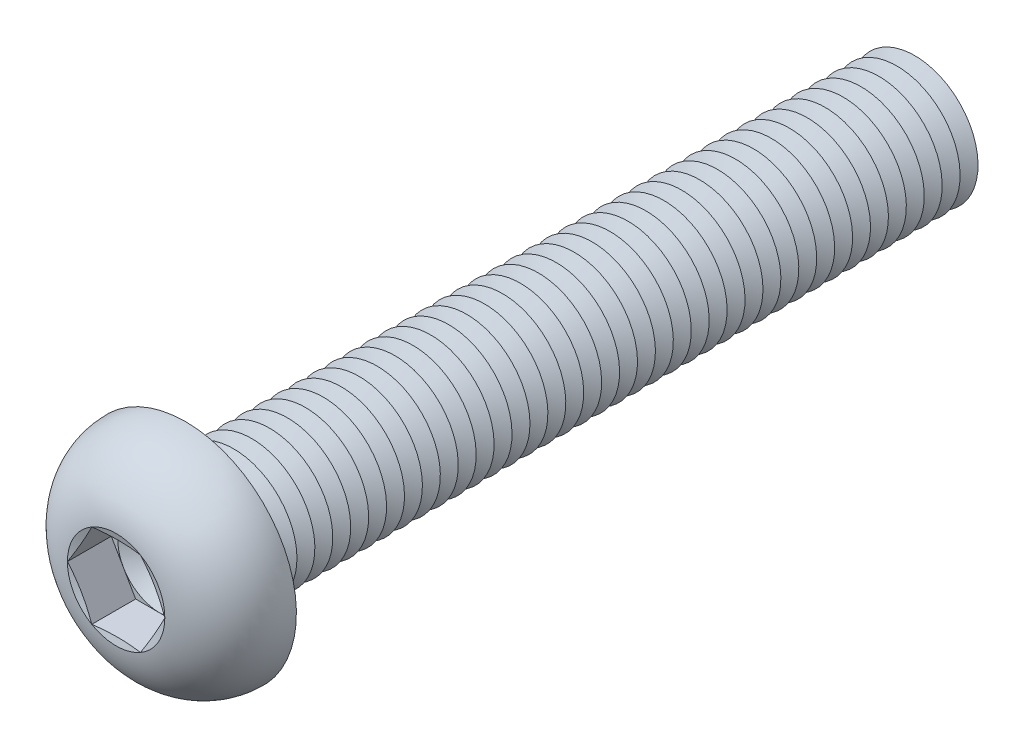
SolidWorks part; units mm, degrees
ref_plane "Front Plane" through (0, 0, 0) normal (0, 0, 1) x (1, 0, 0)
ref_plane "Top Plane" through (0, 0, 0) normal (0, 1, 0) x (1, 0, 0)
ref_plane "Right Plane" through (0, 0, 0) normal (1, 0, 0) x (0, 0, -1)
sketch "Sketch1" plane through (0, 0, 0) normal (1, 0, 0) x (0, 0, -1)
  line L0 (0, 6) -> (0, 10.5)
  line L3 (0, 6) -> (70, 6)
  line L4 (70, 6) -> (70, 0)
  line L5 (70, 0) -> (-6.6, 0) construction
  line L6 (-6.6, 0) -> (70, 0)
  line L7 (-6.6, 4.6188) -> (-6.6, 2.3094) construction
  line L8 (-6.6, 2.3094) -> (-6.6, 0)
  line L9 (-6.6, 4.6188) -> (-5.9812, 2.3094)
  line L10 (-5.9812, 2.3094) -> (-6.6, 2.3094)
  line L11 (70, 0) -> (22.7481, 0) construction
  line L12 (0, 10.5) -> (-6.6, 10.5) construction
  arc A1 (0, 10.5) -> (-6.6, 4.6188) centre (0, 3.8561) ccw
  point P8 (70, 3)
  dimension "D1" = 21
  dimension "D2" = 12
  dimension "D3" = 6.6
  dimension "D4" = 9.2376
  dimension "D5" = 70
  dimension "D6" = 15
revolve "Revolve1" add sketch "Sketch1" angle 360 about L5
fillet "Fillet1" radius 0.85 1 edges at (0, 6, 0)
sketch "Sketch2" plane through (0, 0, 0) normal (1, 0, 0) x (0, 0, -1)
  line L0 (69.15, 6) -> (70.85, 6)
  line L1 (70, 6) -> (0.85, 6) construction
  line L2 (70.85, 6) -> (70, 4.5278)
  line L3 (70, -6) -> (70, 6) construction
  line L4 (70, 4.5278) -> (69.15, 6)
  dimension "D1" = 1.7
revolve "Cut-Revolve1" cut sketch "Sketch2" angle 360 about axis through (0, 0, -70) along (0, 0, -1)
pattern_linear "LPattern1" count 41 spacing 1.7 along (0, 0, 1) of "Cut-Revolve1"
sketch "Sketch3" plane through (0, 0, 6.6) normal (0, 0, 1) x (1, 0, 0)
  line L7 (2.3094, 4) -> (-2.3094, 4)
  line L8 (-2.3094, 4) -> (-4.6188, 0)
  line L9 (-4.6188, 0) -> (-2.3094, -4)
  line L10 (-2.3094, -4) -> (2.3094, -4)
  line L11 (2.3094, -4) -> (4.6188, 0)
  line L12 (4.6188, 0) -> (2.3094, 4)
  circle A0 centre (0, 0) radius 4 construction
  circle A3 centre (0, 0) radius 4.6188 construction
extrude "Cut-Extrude1" cut sketch "Sketch3" against normal blind 4.16
sketch "Sketch4" plane through (0, 0, 2.44) normal (0, 0, 1) x (1, 0, 0)
  line L1 (2.3094, 4) -> (-2.3094, 4) construction
  circle A0 centre (0, 0) radius 4
extrude "Cut-Extrude2" cut sketch "Sketch4" against normal through all draft 60
